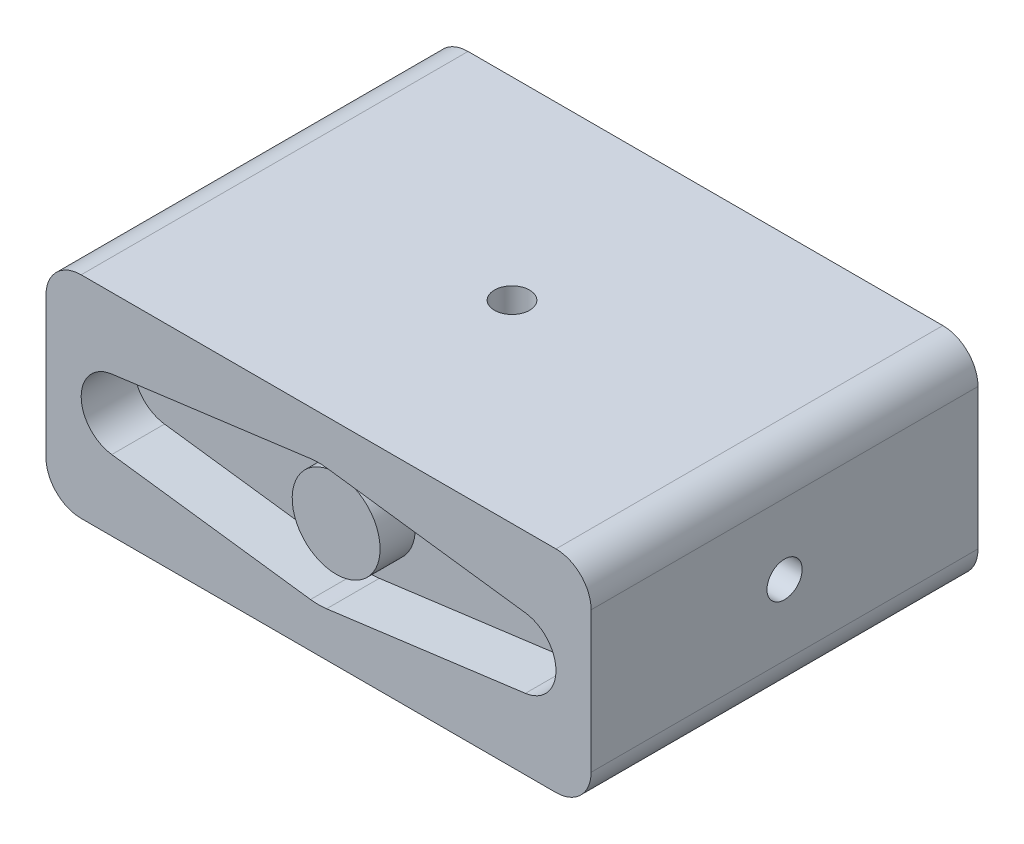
SolidWorks part; units mm, degrees
ref_plane "Front Plane" through (0, 0, 0) normal (0, 0, 1) x (1, 0, 0)
ref_plane "Top Plane" through (0, 0, 0) normal (0, 1, 0) x (1, 0, 0)
ref_plane "Right Plane" through (0, 0, 0) normal (1, 0, 0) x (0, 0, -1)
sketch "Sketch1" plane through (0, 0, 0) normal (0, 0, 1) x (1, 0, 0)
  line L1 (10, -6) -> (-21, -6)
  line L2 (10, -6) -> (10, 6)
  line L3 (10, 6) -> (-21, 6)
  line L4 (-21, -6) -> (-21, 6)
  arc A0 (6.2609, -1.9829) -> (6.2609, 1.9829) centre (6, 0) ccw construction
  arc A1 (-17.2609, 1.9829) -> (-17.2609, -1.9829) centre (-17, 0) ccw construction
  arc A2 (-5.0435, 3.4701) -> (-5.9565, 3.4701) centre (-5.5, 0) ccw construction
  arc A3 (-5.9565, -3.4701) -> (-5.0435, -3.4701) centre (-5.5, 0) ccw construction
  dimension "D1" = 4
  dimension "D2" = 4
  dimension "D3" = 6
  dimension "D4" = 6
extrude "Boss-Extrude1" add sketch "Sketch1" against normal blind 22
fillet "Fillet1" radius 2 4 edges at (10, 6, -11) (-21, 6, -11) (10, -6, -11) (-21, -6, -11)
other "Cavity1"
other "servo<1>@body1"
other "Cavity2"
other "PlaTensor<1>@body1"
sketch "Sketch3" plane through (0, 0, -22) normal (0, 0, -1) x (-1, 0, 0)
  line L0 (16.5, 3.5) -> (16.5, -3.5) construction
  line L1 (-5.5, 3.5) -> (-5.5, -3.5) construction
  line L2 (16.5, 3.5) -> (16.5, -3.5) construction
  line L3 (-5.5, 3.5) -> (-5.5, -3.5) construction
  line L4 (16.5, -3.5) -> (-5.5, -3.5) construction
  line L5 (16.5, 3.5) -> (-5.5, 3.5) construction
  line L6 (17, -4) -> (-6, -4)
  line L7 (-6, 4) -> (-6, -4)
  line L8 (17, 4) -> (-6, 4)
  line L9 (17, 4) -> (17, -4)
  dimension "D1" = 0.5
extrude "Cut-Extrude2" cut sketch "Sketch3" against normal blind 15
sketch "Sketch4" plane through (0, 6, 0) normal (0, 1, 0) x (1, 0, 0)
  line L0 (8, 22) -> (-19, 0) construction
  line L1 (8, 0) -> (-19, 0) construction
  line L2 (-19, 22) -> (-19, 0) construction
  line L3 (-19, 22) -> (8, 0) construction
  circle A0 centre (-5.5, 11) radius 1
  dimension "D1" = 2
extrude "Cut-Extrude7" cut sketch "Sketch4" against normal up to surface (2 mm away) contours A0
sketch "Sketch5" plane through (-21, 0, 0) normal (-1, 0, 0) x (0, 0, 1)
  line L0 (-22, -4) -> (0, 4) construction
  line L1 (0, -4) -> (-22, 4) construction
  circle A0 centre (-11, 0) radius 1
  dimension "D1" = 2
extrude "Cut-Extrude8" cut sketch "Sketch5" against normal up to surface (31 mm away)
